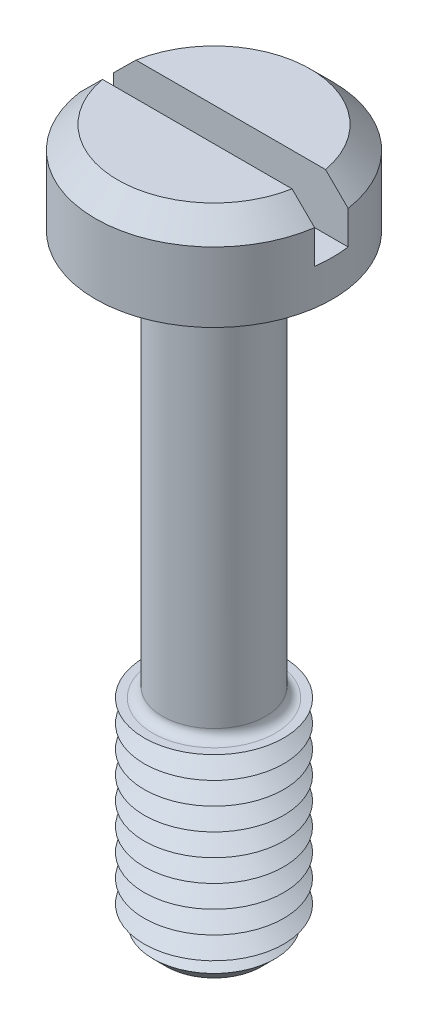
SolidWorks part; units mm, degrees
ref_plane "Front Plane" through (0, 0, 0) normal (0, 0, 1) x (1, 0, 0)
ref_plane "Top Plane" through (0, 0, 0) normal (0, 1, 0) x (1, 0, 0)
ref_plane "Right Plane" through (0, 0, 0) normal (1, 0, 0) x (0, 0, -1)
sketch "Sketch1" plane through (0, 0, 0) normal (0, 1, 0) x (1, 0, 0)
  circle A0 centre (0, 0) radius 4.25
  dimension "D1" = 8.5
extrude "Boss-Extrude1" add sketch "Sketch1" along normal blind 3.3
sketch "Sketch2" plane through (0, 0, 0) normal (0, -1, 0) x (1, 0, 0)
  circle A0 centre (0, 0) radius 1.85
  dimension "D1" = 3.7
extrude "Boss-Extrude2" add sketch "Sketch2" along normal blind 22
sketch "Sketch3" plane through (0, -22, 0) normal (0, -1, 0) x (1, 0, 0)
  circle A0 centre (0, 0) radius 2.5
  dimension "D1" = 5
extrude "Boss-Extrude3" add sketch "Sketch3" against normal blind 7.5
chamfer "Chamfer1" distance 0.8 angle 45 1 edges at (0, -22, -2.5)
sketch "Sketch4" plane through (0, 0, 0) normal (1, 0, 0) x (0, 0, -1)
  line L0 (0, -6.5871) -> (0, -12.0372) construction
sketch "Sketch5" plane through (0, 0, 0) normal (1, 0, 0) x (0, 0, -1)
  line L0 (-2.5, -14.5) -> (-1.8072, -14.9)
  line L1 (-1.8072, -14.9) -> (-2.5, -15.3)
  line L2 (-2.5, -14.5) -> (-2.5, -21.2) construction
  line L3 (-2.5, -15.3) -> (-2.5, -14.5)
  dimension "D1" = 0.8
revolve "Cut-Revolve1" cut sketch "Sketch5" angle 360 about L0
pattern_linear "LPattern1" count 9 spacing 0.8 along (0, -1, 0) of "Cut-Revolve1"
fillet "Fillet1" radius 0.35 2 edges at (0, -14.5, -1.85) (0, 0, -1.85)
chamfer "Chamfer2" distance 0.8 angle 45 1 edges at (0, 3.3, 4.25)
sketch "Sketch6" plane through (0, 3.3, 0) normal (0, 1, 0) x (1, 0, 0)
  line L1 (4.25, -0.6) -> (-4.25, -0.6)
  line L2 (4.25, -0.6) -> (4.25, 0.6)
  line L3 (4.25, 0.6) -> (-4.25, 0.6)
  line L4 (-4.25, -0.6) -> (-4.25, 0.6)
  line L5 (4.25, -0.6) -> (-4.25, 0.6) construction
  line L6 (4.25, 0.6) -> (-4.25, -0.6) construction
  circle A0 centre (0, 0) radius 4.25 construction
  point P0 (0, 0)
  dimension "D1" = 1.2
extrude "Cut-Extrude1" cut sketch "Sketch6" against normal blind 2
